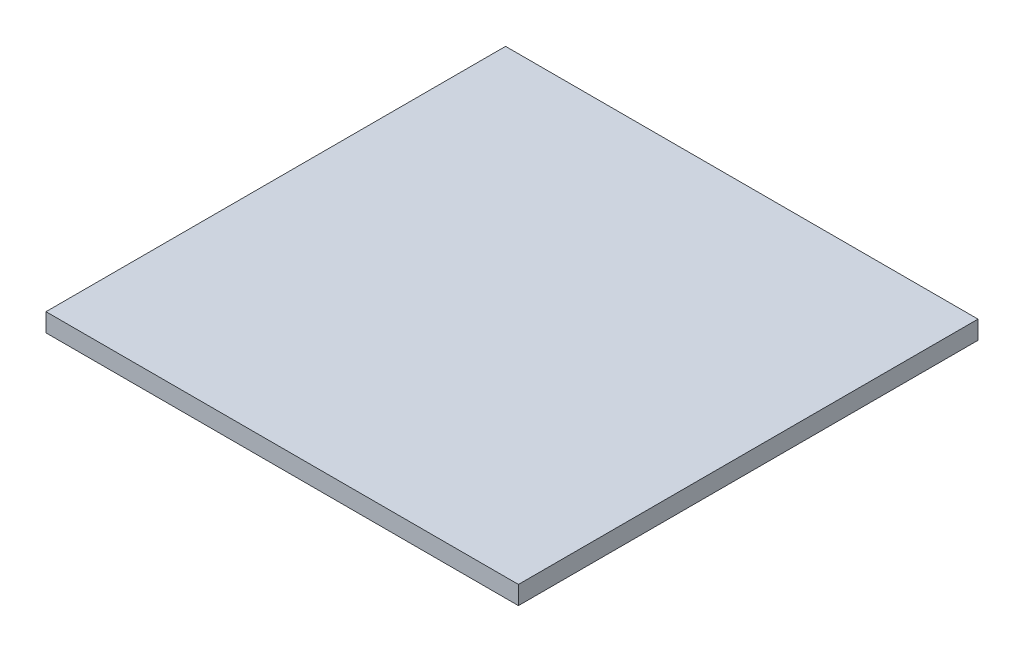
SolidWorks part; units mm, degrees
ref_plane "Front Plane" through (0, 0, 0) normal (0, 0, 1) x (1, 0, 0)
ref_plane "Top Plane" through (0, 0, 0) normal (0, 1, 0) x (1, 0, 0)
ref_plane "Right Plane" through (0, 0, 0) normal (1, 0, 0) x (0, 0, -1)
sketch "Sketch1" plane through (0, 0, 0) normal (0, 1, 0) x (1, 0, 0)
  line L1 (-12.9724, -15.9103) -> (12.7276, -15.9103)
  line L2 (-12.9724, -15.9103) -> (-12.9724, 9.0897)
  line L3 (-12.9724, 9.0897) -> (12.7276, 9.0897)
  line L4 (12.7276, -15.9103) -> (12.7276, 9.0897)
  dimension "D1" = 25.7
  dimension "D2" = 25
extrude "Boss-Extrude1" add sketch "Sketch1" along normal blind 1
